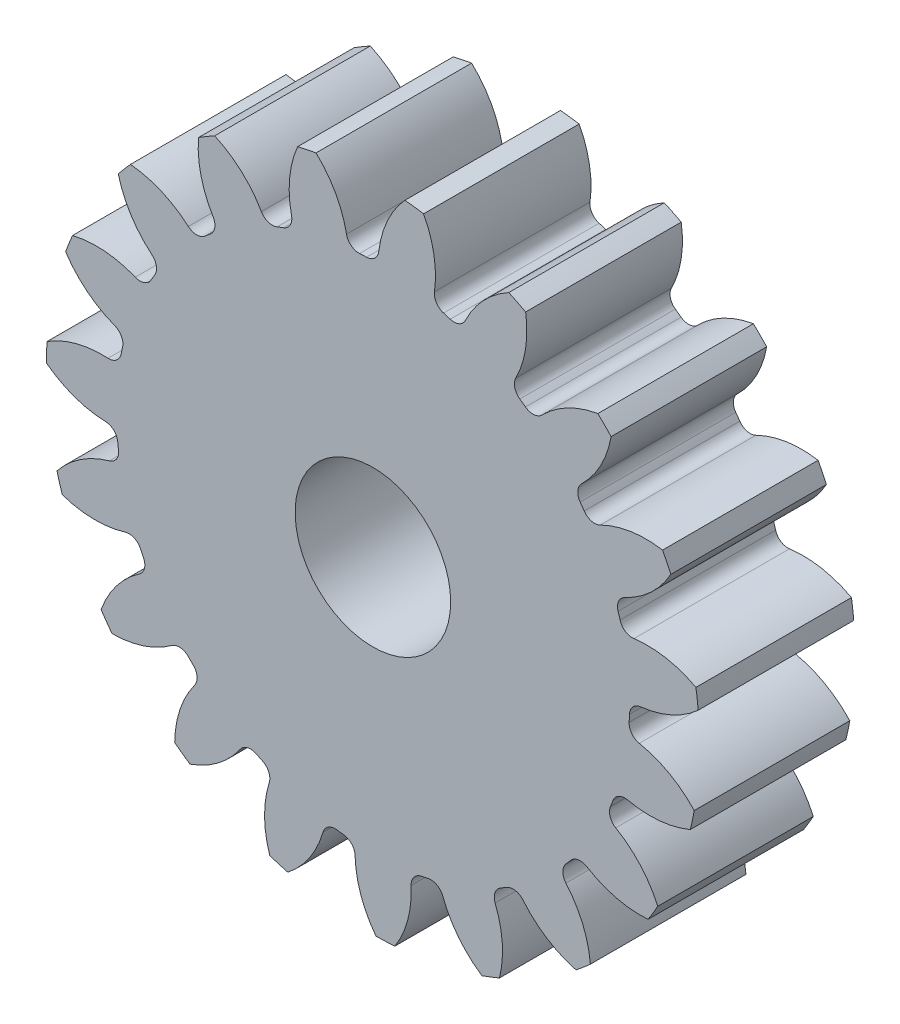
SolidWorks part; units mm, degrees
ref_plane "Front" through (0, 0, 0) normal (0, 0, 1) x (1, 0, 0)
ref_plane "Top" through (0, 0, 0) normal (0, 1, 0) x (1, 0, 0)
ref_plane "Right" through (0, 0, 0) normal (1, 0, 0) x (0, 0, -1)
sketch "Sketch3" plane through (0, 0, 0) normal (0, 0, 1) x (1, 0, 0)
  circle A0 centre (0, 0) radius 213.36
  dimension "od" = 426.72
extrude "gearBody" add sketch "Sketch3" along normal blind 101.6
sketch "Sketch2" plane through (0, 0, 0) normal (0, 0, 1) x (1, 0, 0)
  line L0 (0, 0) -> (167.5901, 69.4181) construction
  line L1 (210.7079, -39.2866) -> (0, 0) construction
  line L2 (0, 0) -> (36.3143, 0) construction
  line L3 (192.8995, 7.363) -> (191.4886, -24.4245) construction
  line L5 (192.1941, -8.5308) -> (0, 0) construction
  line L7 (0, 0) -> (181.3983, 0) construction
  arc A0 (181.3578, 3.8296) -> (180.3053, -19.8824) centre (0, 0) ccw construction
  arc A1 (212.4548, 19.6329) -> (209.8799, -38.3787) centre (0, 0) ccw construction
  arc A2 (192.8995, 7.363) -> (191.4886, -24.4245) centre (0, 0) ccw construction
  arc A3 (167.359, -9.7024) -> (167.5605, -5.1634) centre (0, 0) ccw
  arc A4 (210.7079, -39.2866) -> (173.9858, -18.2891) centre (160.7808, -83.9933) ccw
  arc A5 (210.7079, -39.2866) -> (213.36, 20.4638) centre (0, 0) ccw
  arc A6 (213.36, 20.4638) -> (174.922, 2.8024) centre (167.5901, 69.4181) cw
  arc A7 (167.5605, -5.1634) -> (174.922, 2.8024) centre (175.8268, -5.4182) cw
  arc A8 (173.9858, -18.2891) -> (167.359, -9.7024) centre (175.6154, -10.181) cw
  point P6 (213.36, 20.4638)
  point P22 (210.7079, -39.2866)
  dimension "baseDia" = 362.7965
  dimension "od" = 426.72
  dimension "pd" = 386.08
  dimension "rd" = 335.28
  dimension "rFillet" = 8.2702
  dimension "pointX" = 213.36
  dimension "pointY" = 20.4638
  dimension "CTT" = 31.7875
  dimension "flankCenterAngle" = 22.5
extrude "toothCut" cut sketch "Sketch2" along normal through all
pattern_circular "CirPattern1" count 19 over 360 about axis through (0, 0, 0) along (0, 0, 1) of "toothCut"
sketch "hub1Dia" plane through (0, 0, 0) normal (0, 0, -1) x (-1, 0, 0)
  circle A0 centre (0, 0) radius 12.7
  dimension "hub1Dia" = 25.4
sketch "hub2Dia" plane through (0, 0, 101.6) normal (0, 0, 1) x (1, 0, 0)
  circle A0 centre (0, 0) radius 12.7
  dimension "hub2dia" = 25.4
sketch "boreDia" plane through (0, 0, 0) normal (0, 0, 1) x (1, 0, 0)
  circle A0 centre (0, 0) radius 50.8
  dimension "boreDia" = 101.6
extrude "bore" cut sketch "boreDia" against normal mid plane 25400
